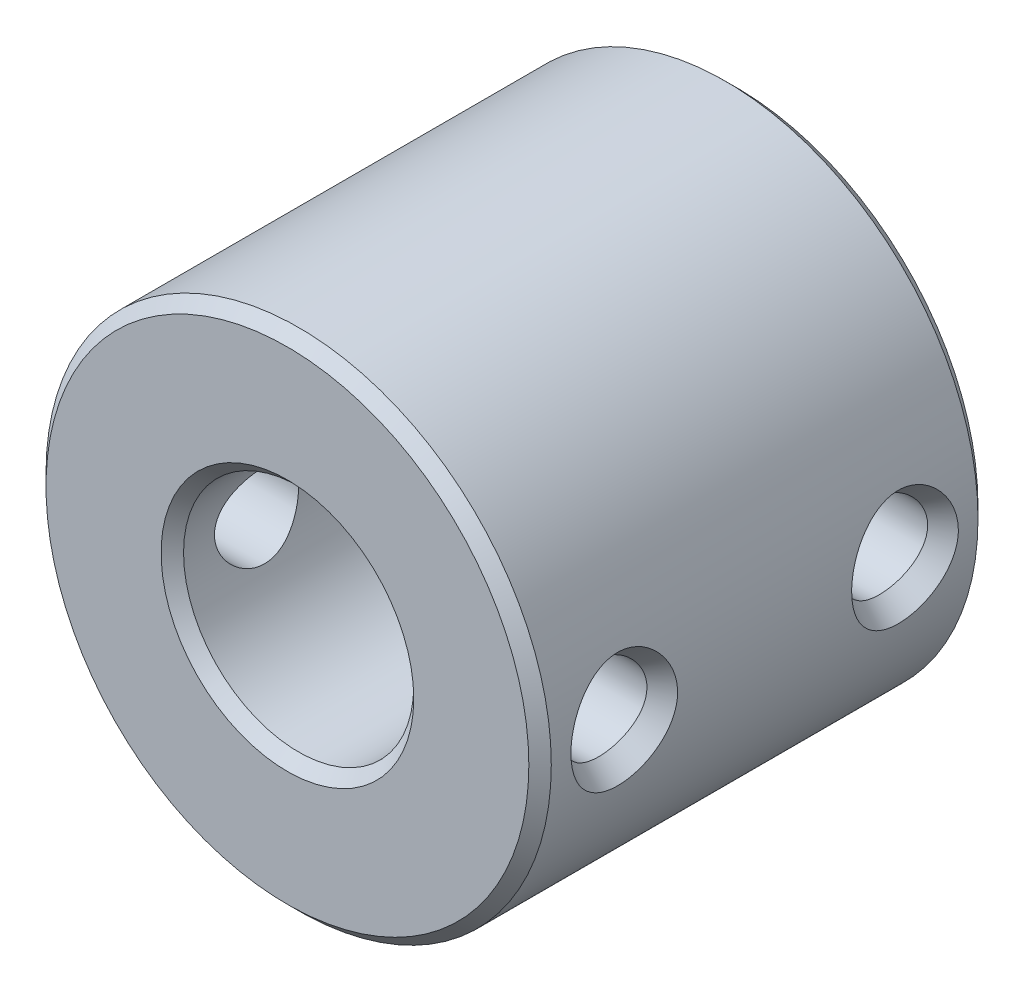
SolidWorks part; units mm, degrees
ref_plane "Front" through (0, 0, 0) normal (0, 0, 1) x (1, 0, 0)
ref_plane "Top" through (0, 0, 0) normal (0, 1, 0) x (1, 0, 0)
ref_plane "Right" through (0, 0, 0) normal (1, 0, 0) x (0, 0, -1)
sketch "Sketch1" plane through (0, 0, 0) normal (0, 0, 1) x (1, 0, 0)
  circle A0 centre (0, 0) radius 2.05
  circle A1 centre (0, 0) radius 4.5
  dimension "D1" = 4.1
  dimension "D2" = 9
extrude "Base-Extrude" add sketch "Sketch1" along normal blind 8
chamfer "Chamfer1" distance 0.2 angle 45 4 edges at (4.5, 0, 0) (4.5, 0, 8) (2.05, 0, 0) (2.05, 0, 8)
sketch "Sketch2" plane through (0, 0, 0) normal (1, 0, 0) x (0, 0, -1)
  line L0 (-7.8, 0) -> (-0.2, 0) construction
  line L1 (0, -4.3) -> (0, 4.3) construction
  line L3 (0, 0) -> (-17.8624, 0) construction
  circle A0 centre (-1.5, 0) radius 0.75
  circle A1 centre (-6.5, 0) radius 0.75
  dimension "D1" = 1.5
  dimension "D2" = 1.5
  dimension "D3" = 5
extrude "Cut-Extrude1" cut sketch "Sketch2" against normal through all and the other way through all
chamfer "Chamfer2" distance 0.2 angle 60 4 edges at (-4.4971, 0.1609, 0.7675) (4.4971, 0.1609, 2.2325) (-4.4971, 0.1609, 5.7675) (4.4971, 0.1609, 7.2325)
